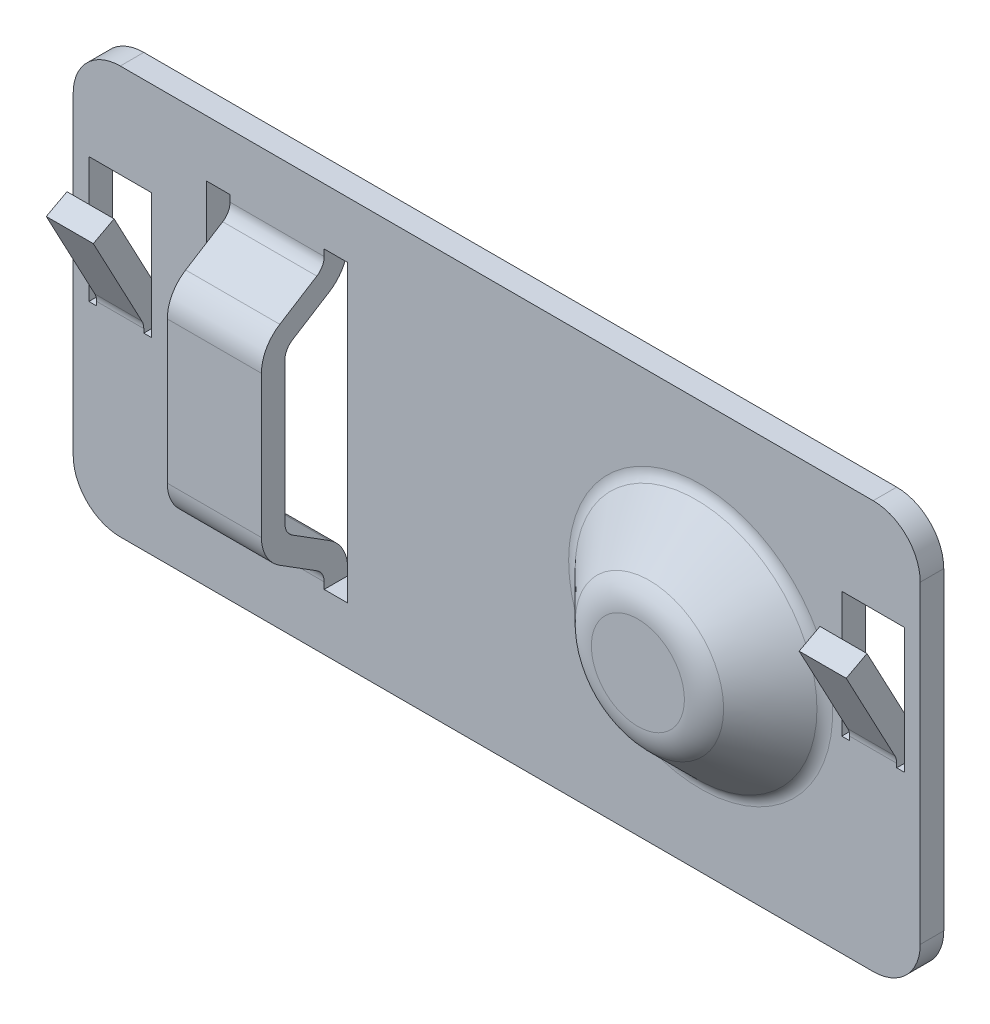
SolidWorks part; units mm, degrees
ref_plane "Face" through (0, 0, 0) normal (0, 0, 1) x (1, 0, 0)
ref_plane "Dessus" through (0, 0, 0) normal (0, 1, 0) x (1, 0, 0)
ref_plane "Droite" through (0, 0, 0) normal (1, 0, 0) x (0, 0, -1)
sketch "Esquisse1" plane through (0, 0, 0) normal (0, 0, 1) x (1, 0, 0)
  line L0 (-33.5479, 0) -> (53.0039, 0) construction
  line L1 (-18.5, -6.5) -> (5.5, -6.5)
  line L2 (-20, -5) -> (-20, 5)
  line L3 (-18.5, 6.5) -> (5.5, 6.5)
  line L4 (7, -5) -> (7, 5)
  line L5 (0, -21.6379) -> (0, 17.6376) construction
  line L7 (-19.5, 3.5) -> (-17.5, 3.5)
  line L8 (-19.5, 3.5) -> (-19.5, -0.5)
  line L9 (-19.5, -0.5) -> (-17.5, -0.5)
  line L10 (-17.5, 3.5) -> (-17.5, -0.5)
  line L11 (-15.75, 4.7) -> (-11.25, 4.7)
  line L12 (-15.75, 4.7) -> (-15.75, -4.7)
  line L13 (-15.75, -4.7) -> (-11.25, -4.7)
  line L14 (-11.25, 4.7) -> (-11.25, -4.7)
  line L15 (4.5, 3.5) -> (6.5, 3.5)
  line L16 (4.5, 3.5) -> (4.5, -0.5)
  line L17 (4.5, -0.5) -> (6.5, -0.5)
  line L18 (6.5, 3.5) -> (6.5, -0.5)
  arc A0 (5.5, 6.5) -> (7, 5) centre (5.5, 5) cw
  arc A1 (-20, 5) -> (-18.5, 6.5) centre (-18.5, 5) cw
  arc A2 (-18.5, -6.5) -> (-20, -5) centre (-18.5, -5) cw
  arc A3 (5.5, -6.5) -> (7, -5) centre (5.5, -5) ccw
  circle A4 centre (0, 0) radius 3.69
  point P10 (7, 6.5)
  point P13 (-20, 6.5)
  point P18 (7, -6.5)
  dimension "D4" = 1.5
  dimension "D5" = 7.38
  dimension "D1" = 27
  dimension "D2" = 7
  dimension "D3" = 13
  dimension "D6" = 2
  dimension "D7" = 4
  dimension "D8" = 4.5
  dimension "D9" = 4.25
  dimension "D10" = 0.5
  dimension "D11" = 0.5
  dimension "D12" = 2
  dimension "D13" = 3
  dimension "D14" = 4
  dimension "D15" = 9.4
extrude "Extrusion1" add sketch "Esquisse1" along normal blind 0.75
sketch "Esquisse2" plane through (0, 0, 0) normal (1, 0, 0) x (0, 0, -1)
  line L0 (1.9887, 0) -> (-4.5494, 0) construction
  line L1 (0, 3.69) -> (-2, 1.69)
  line L2 (0, -5) -> (0, 5) construction
  line L3 (-2, 1.69) -> (-2, 0)
  line L4 (-2, 0) -> (-2.75, 0)
  line L5 (-2.75, 0) -> (-2.75, 2.0007)
  line L6 (-2.75, 2.0007) -> (-0.75, 4.0007)
  line L7 (-0.75, -5) -> (-0.75, 5) construction
  line L8 (-0.75, 4.0007) -> (0, 3.69)
  line L9 (0, 3.69) -> (-0.75, 3.69) construction
  dimension "D1" = 0.75
  dimension "D2" = 0.75
  dimension "D4" = 45
  dimension "D5" = 2
revolve "Révolution1" add sketch "Esquisse2" angle 360 about L0
fillet "Congé1" radius 1.25 2 edges at (-3.69, 0, 0) (-2.0007, 0, 2.75)
fillet "Congé2" radius 0.5 2 edges at (-4.0007, 0, 0.75) (-1.69, 0, 2)
ref_plane "Plan1" through (5.5, 0, 0) normal (1, 0, 0) x (0, 0, -1)
ref_plane "Plan2" through (-13.5, 0, 0) normal (1, 0, 0) x (0, 0, -1)
sketch "Esquisse3" plane through (-13.5, 0, 0) normal (1, 0, 0) x (0, 0, -1)
  line L0 (-0.75, -4.2146) -> (-2.75, -2.9586)
  line L1 (-2.75, -2.9586) -> (-2.75, 2.9586)
  line L2 (-2.75, 2.9586) -> (-0.75, 4.2146)
  line L3 (-0.75, 6.5) -> (-0.75, 5) construction
  line L4 (-0.75, -5) -> (-0.75, -6.5) construction
  line L6 (-0.75, -5) -> (-0.75, 5) construction
  line L7 (-2, -2.5439) -> (0, -3.8)
  line L8 (0, -5) -> (0, 5) construction
  line L10 (0, 3.8) -> (-2, 2.5439)
  line L11 (-2, 2.5439) -> (-2, -2.5439)
  line L12 (1.9887, 0) -> (-4.5494, 0) construction
  line L13 (-0.75, 4.2146) -> (-0.75, 4.7566)
  line L14 (-0.75, 4.7566) -> (0, 4.7566)
  line L15 (0, 4.7566) -> (0, 3.8)
  line L16 (0, -3.8) -> (0, -4.7)
  line L17 (0, -4.7) -> (-0.75, -4.7)
  line L18 (-0.75, -4.7) -> (-0.75, -4.2146)
  dimension "D1" = 122.13
  dimension "D2" = 122.13
  dimension "D3" = 2
  dimension "D4" = 0.75
  dimension "D5" = 0.75
  dimension "D6" = 0.75
  dimension "D7" = 7.6
  dimension "D8" = 3.8
extrude "Extrusion2" add sketch "Esquisse3" along normal mid plane 3
fillet "Congé3" radius 1.25 4 edges at (-13.5, -2.9586, 2.75) (-13.5, 2.9586, 2.75) (-13.5, 3.8, 0) (-13.5, -3.8, 0)
fillet "Congé4" radius 0.5 4 edges at (-13.5, 2.5439, 2) (-13.5, -2.5439, 2) (-13.5, -4.2146, 0.75) (-13.5, 4.2146, 0.75)
sketch "Esquisse4" plane through (5.5, 0, 0) normal (1, 0, 0) x (0, 0, -1)
  line L0 (0, -0.063) -> (-1.6967, 3.1281)
  line L1 (-1.6967, 3.1281) -> (-2.3589, 2.776)
  line L2 (-2.3589, 2.776) -> (-0.75, -0.25)
  line L3 (-0.75, -5) -> (-0.75, 5) construction
  line L4 (-0.75, -0.25) -> (-0.75, -0.5)
  line L5 (-0.75, 6.5) -> (-0.75, 5) construction
  line L7 (0, -0.5) -> (0, -0.063)
  line L8 (-0.75, -0.5) -> (0, -0.5)
  circle A0 centre (0, -0.063) radius 3.6141 construction
  dimension "D1" = 0.75
  dimension "D2" = 28
  dimension "D3" = 0.25
extrude "Extrusion3" add sketch "Esquisse4" along normal mid plane 1.5
fillet "Congé5" radius 0.5 1 edges at (5.5, -0.25, 0.75)
fillet "Congé6" radius 1.25 1 edges at (5.5, -0.063, 0)
pattern_linear "Répétition linéaire1" count 2 spacing 24 along (-1, 0, 0) of "Congé6", "Congé5", "Extrusion3"
